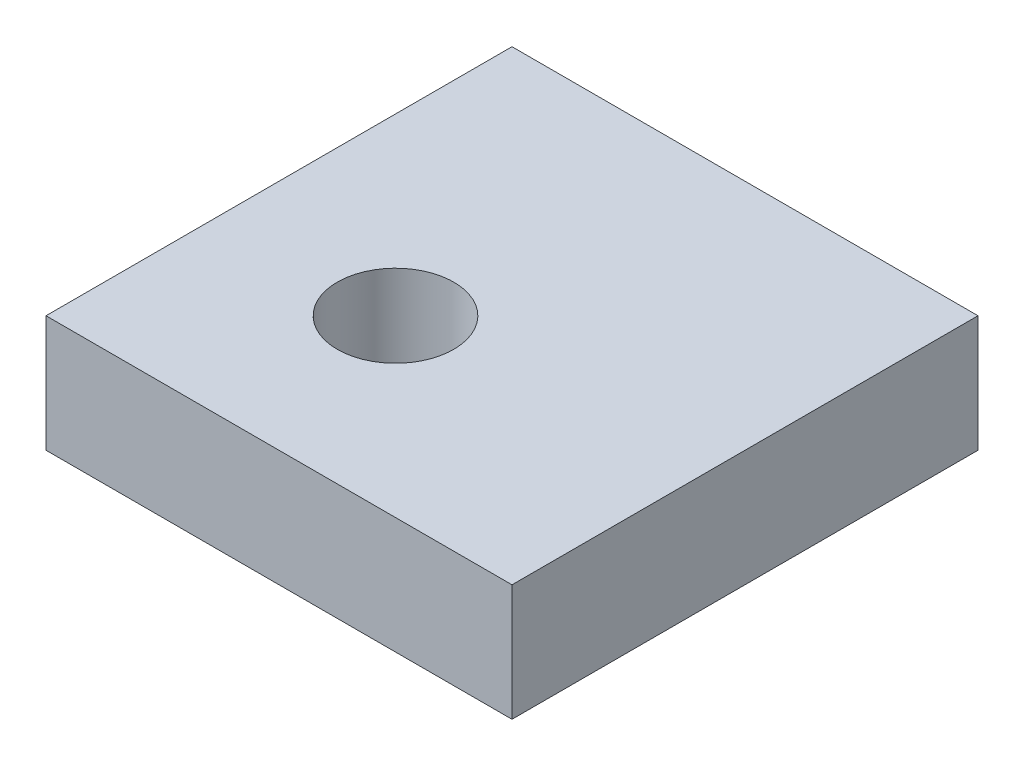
SolidWorks part; units mm, degrees
ref_plane "Front Plane" through (0, 0, 0) normal (0, 0, 1) x (1, 0, 0)
ref_plane "Top Plane" through (0, 0, 0) normal (0, 1, 0) x (1, 0, 0)
ref_plane "Right Plane" through (0, 0, 0) normal (1, 0, 0) x (0, 0, -1)
sketch "Sketch1" plane through (0, 0, 0) normal (0, 1, 0) x (1, 0, 0)
  line L1 (-6.35, -6.35) -> (6.35, -6.35)
  line L2 (-6.35, -6.35) -> (-6.35, 6.35)
  line L3 (-6.35, 6.35) -> (6.35, 6.35)
  line L4 (6.35, -6.35) -> (6.35, 6.35)
  line L5 (-6.35, -6.35) -> (6.35, 6.35) construction
  line L6 (-6.35, 6.35) -> (6.35, -6.35) construction
  point P0 (0, 0)
  dimension "D1" = 12.7
  dimension "D2" = 12.7
extrude "Boss-Extrude1" add sketch "Sketch1" along normal blind 3.175
sketch "Sketch2" plane through (0, 3.175, 0) normal (0, 1, 0) x (1, 0, 0)
  line L0 (-6.35, 6.35) -> (-6.35, -6.35) construction
  line L1 (6.35, 6.35) -> (-6.35, 6.35) construction
  circle A0 centre (-1.5875, -1.5875) radius 1.5875
  dimension "D1" = 3.175
  dimension "D2" = 4.7625
  dimension "D3" = 7.9375
extrude "Cut-Extrude1" cut sketch "Sketch2" against normal through all
